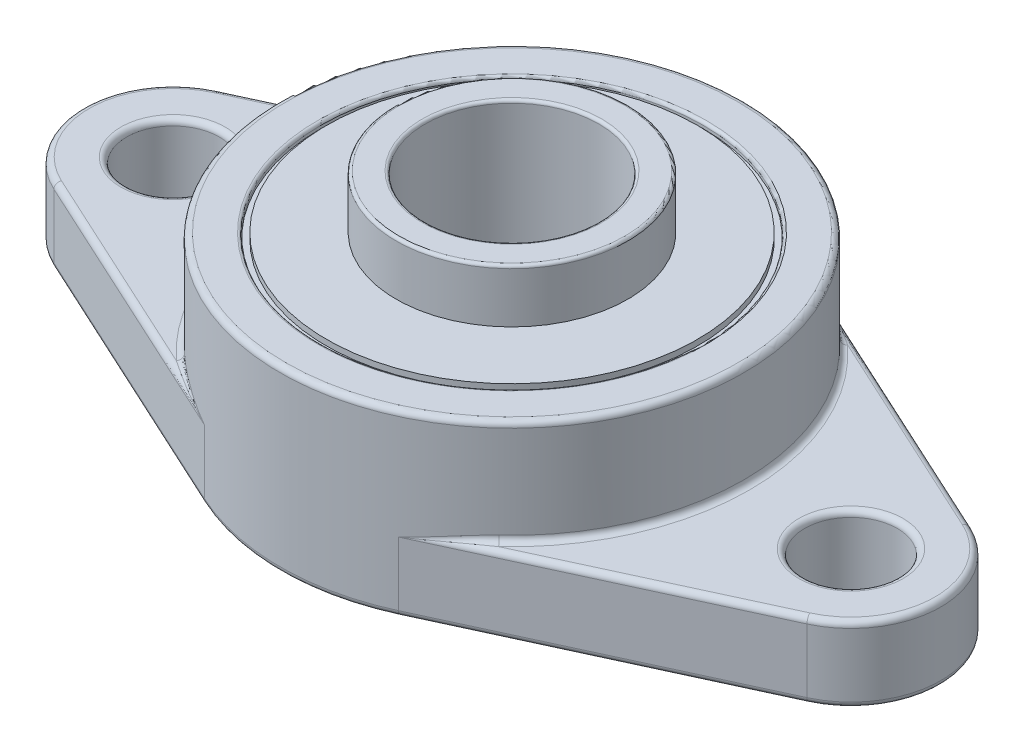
SolidWorks part; units mm, degrees
ref_plane "Ön Düzlem" through (0, 0, 0) normal (0, 0, 1) x (1, 0, 0)
ref_plane "Üst Düzlem" through (0, 0, 0) normal (0, 1, 0) x (1, 0, 0)
ref_plane "Sağ Düzlem" through (0, 0, 0) normal (1, 0, 0) x (0, 0, -1)
sketch "Revolve Sketch" plane through (0, 0, 0) normal (0, 0, 1) x (1, 0, 0)
  line L0 (0, -40.5551) -> (0, 62.3107) construction
  line L1 (-15.5, -31) -> (-40, -31)
  line L4 (-40, -31) -> (-40, -1)
  line L5 (-39, 0) -> (-33, 0)
  line L6 (-33, 0) -> (-33, -1)
  line L7 (-33, -1) -> (-32, -1)
  line L8 (-32, -1) -> (-32, 0)
  line L9 (-32, 0) -> (-20, 0)
  line L10 (-20, 0) -> (-20, 8.7)
  line L11 (-19.5, 9.2) -> (-15.5, 9.2)
  line L12 (-15, 8.7) -> (-15, -30.5)
  line L13 (-40, -31) -> (0, -31) construction
  line L14 (0, -31) -> (40, -31) construction
  line L15 (-15, -30.5) -> (0, -30.5) construction
  line L16 (0, -30.5) -> (15, -30.5) construction
  arc A1 (-15.5, 9.2) -> (-15, 8.7) centre (-15.5, 8.7) cw
  arc A2 (-20, 8.7) -> (-19.5, 9.2) centre (-19.5, 8.7) cw
  arc A4 (-40, -1) -> (-39, 0) centre (-39, -1) cw
  arc A5 (-15, -30.5) -> (-15.5, -31) centre (-15.5, -30.5) cw
  point P27 (-40, 0)
revolve "Bearing Revolve" add sketch "Revolve Sketch" angle 360 about L0
sketch "Flange Sketch" plane through (0, -31, 0) normal (0, 1, 0) x (1, 0, 0)
  line L0 (58.5, 0) -> (0, 0) construction
  line L1 (0, 0) -> (-58.5, 0) construction
  line L2 (-64.9915, 14.0752) -> (-16.7521, 36.3231)
  line L3 (64.9915, -14.0752) -> (16.7521, -36.3231)
  line L5 (-64.9915, -14.0752) -> (-16.7521, -36.3231)
  line L6 (64.9915, 14.0752) -> (16.7521, 36.3231)
  arc A0 (-64.9915, 14.0752) -> (-64.9915, -14.0752) centre (-58.5, 0) ccw
  arc A1 (-16.7521, 36.3231) -> (-16.7521, -36.3231) centre (0, 0) ccw
  circle A2 centre (0, 0) radius 40 construction
  arc A3 (64.9915, 14.0752) -> (64.9915, -14.0752) centre (58.5, 0) cw
  arc A4 (16.7521, -36.3231) -> (16.7521, 36.3231) centre (0, 0) ccw
  circle A5 centre (-58.5, 0) radius 8
  circle A6 centre (58.5, 0) radius 8
  dimension "N" = 16
  dimension "H" = 148
  dimension "J" = 117
extrude "Flange" add sketch "Flange Sketch" along normal blind 13
fillet "Flange Radius" radius 1 18 edges at (0, -31, 40) (0, -31, -40) (40.8718, -18, 25.1991) (40.8718, -18, -25.1991) (40.8718, -31, 25.1991) (40.8718, -31, -25.1991) (-40.8718, -31, -25.1991) (-74, -31, 0) (-40.8718, -31, 25.1991) (74, -18, 0) (74, -31, 0) (-58.5, -18, 8) (-40.8718, -18, -25.1991) (-40, -18, 0) (-40.8718, -18, 25.1991) (-74, -18, 0) (58.5, -18, 8) (40, -18, 0)
fillet "Inner radius" radius 0.5 1 edges at (0, 0, -33)
equation "\"D4@Revolve Sketch\" = \"Shaft Diam@Revolve Sketch\" / 1.5"
